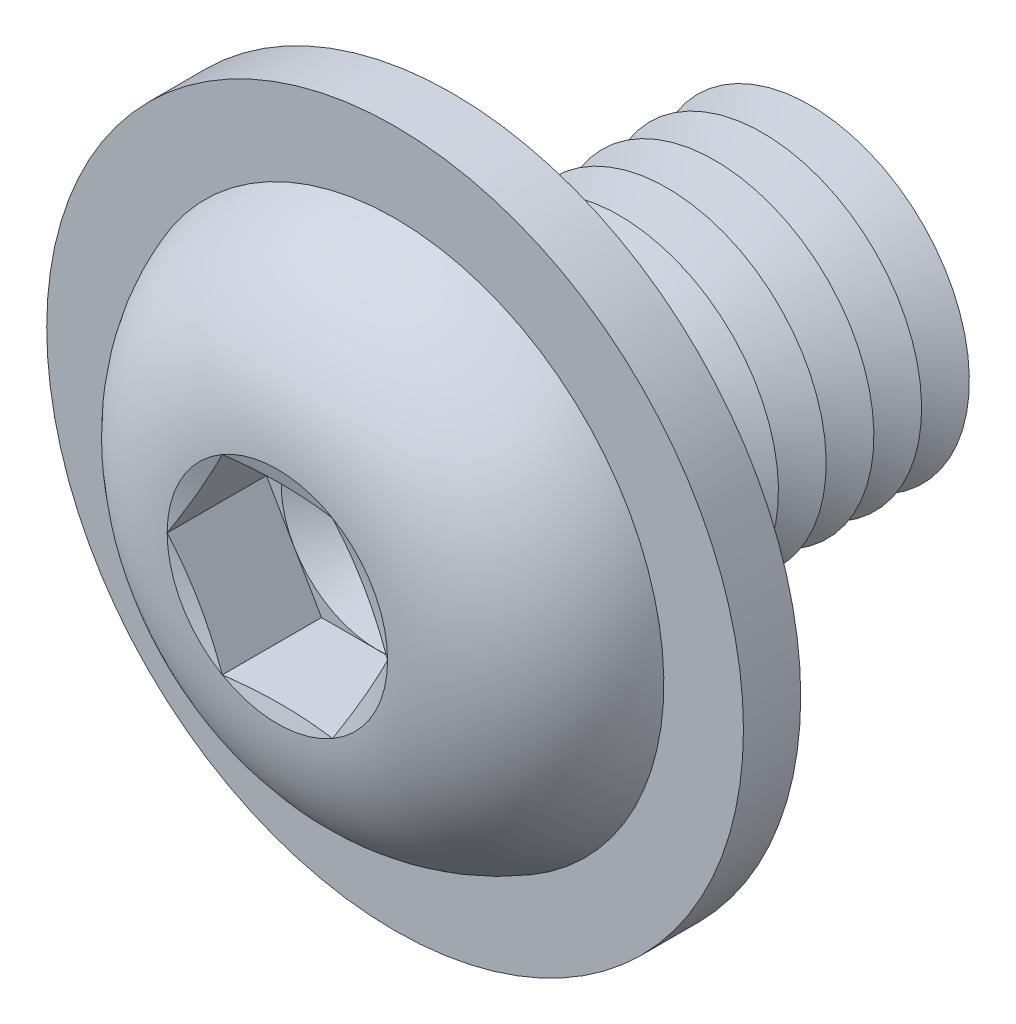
SolidWorks part; units mm, degrees
ref_plane "Front Plane" through (0, 0, 0) normal (0, 0, 1) x (1, 0, 0)
ref_plane "Top Plane" through (0, 0, 0) normal (0, 1, 0) x (1, 0, 0)
ref_plane "Right Plane" through (0, 0, 0) normal (1, 0, 0) x (0, 0, -1)
sketch "Sketch1" plane through (0, 0, 0) normal (1, 0, 0) x (0, 0, -1)
  line L0 (0, 5) -> (0, 8.75)
  line L3 (0, 5) -> (12, 5)
  line L4 (12, 5) -> (12, 0)
  line L5 (12, 0) -> (-5.5, 0) construction
  line L6 (-5.5, 0) -> (12, 0)
  line L7 (-5.5, 3.4641) -> (-5.5, 1.732) construction
  line L8 (-5.5, 1.732) -> (-5.5, 0)
  line L9 (-5.5, 3.4641) -> (-5.0359, 1.732)
  line L10 (-5.0359, 1.732) -> (-5.5, 1.732)
  line L11 (12, 0) -> (22.7481, 0) construction
  line L12 (0, 8.75) -> (-5.5, 8.75) construction
  arc A1 (0, 8.75) -> (-5.5, 3.4641) centre (0, 3.2457) ccw
  point P8 (12, 2.5)
  dimension "D1" = 17.5
  dimension "D2" = 10
  dimension "D3" = 5.5
  dimension "D4" = 6.9282
  dimension "D5" = 12
  dimension "D6" = 15
revolve "Revolve1" add sketch "Sketch1" angle 360 about L5
fillet "Fillet1" radius 0.75 1 edges at (0, 5, 0)
sketch "Sketch2" plane through (0, 0, 0) normal (1, 0, 0) x (0, 0, -1)
  line L0 (11.25, 5) -> (12.75, 5)
  line L1 (12, 5) -> (0.75, 5) construction
  line L2 (12.75, 5) -> (12, 3.701)
  line L3 (12, -5) -> (12, 5) construction
  line L4 (12, 3.701) -> (11.25, 5)
  dimension "D1" = 1.5
revolve "Cut-Revolve1" cut sketch "Sketch2" angle 360 about axis through (0, 0, -12) along (0, 0, -1)
pattern_linear "LPattern1" count 8 spacing 1.5 along (0, 0, 1) of "Cut-Revolve1"
sketch "Sketch3" plane through (0, 0, 5.5) normal (0, 0, 1) x (1, 0, 0)
  line L7 (1.7321, 3) -> (-1.7321, 3)
  line L8 (-1.7321, 3) -> (-3.4641, 0)
  line L9 (-3.4641, 0) -> (-1.7321, -3)
  line L10 (-1.7321, -3) -> (1.7321, -3)
  line L11 (1.7321, -3) -> (3.4641, 0)
  line L12 (3.4641, 0) -> (1.7321, 3)
  circle A0 centre (0, 0) radius 3 construction
  circle A3 centre (0, 0) radius 3.4641 construction
extrude "Cut-Extrude1" cut sketch "Sketch3" against normal blind 3.12
sketch "Sketch4" plane through (0, 0, 2.38) normal (0, 0, 1) x (1, 0, 0)
  line L1 (1.7321, 3) -> (-1.7321, 3) construction
  circle A0 centre (0, 0) radius 3
extrude "Cut-Extrude2" cut sketch "Sketch4" against normal through all draft 60
sketch "Sketch5" plane through (0, 0, 0) normal (0, 0, -1) x (-1, 0, 0)
  circle A0 centre (0, 0) radius 10.95
  circle A1 centre (0, 0) radius 5.75
  circle A2 centre (0, 0) radius 5.75 construction
  dimension "D1" = 21.9
extrude "Boss-Extrude1" add sketch "Sketch5" against normal blind 1.8
